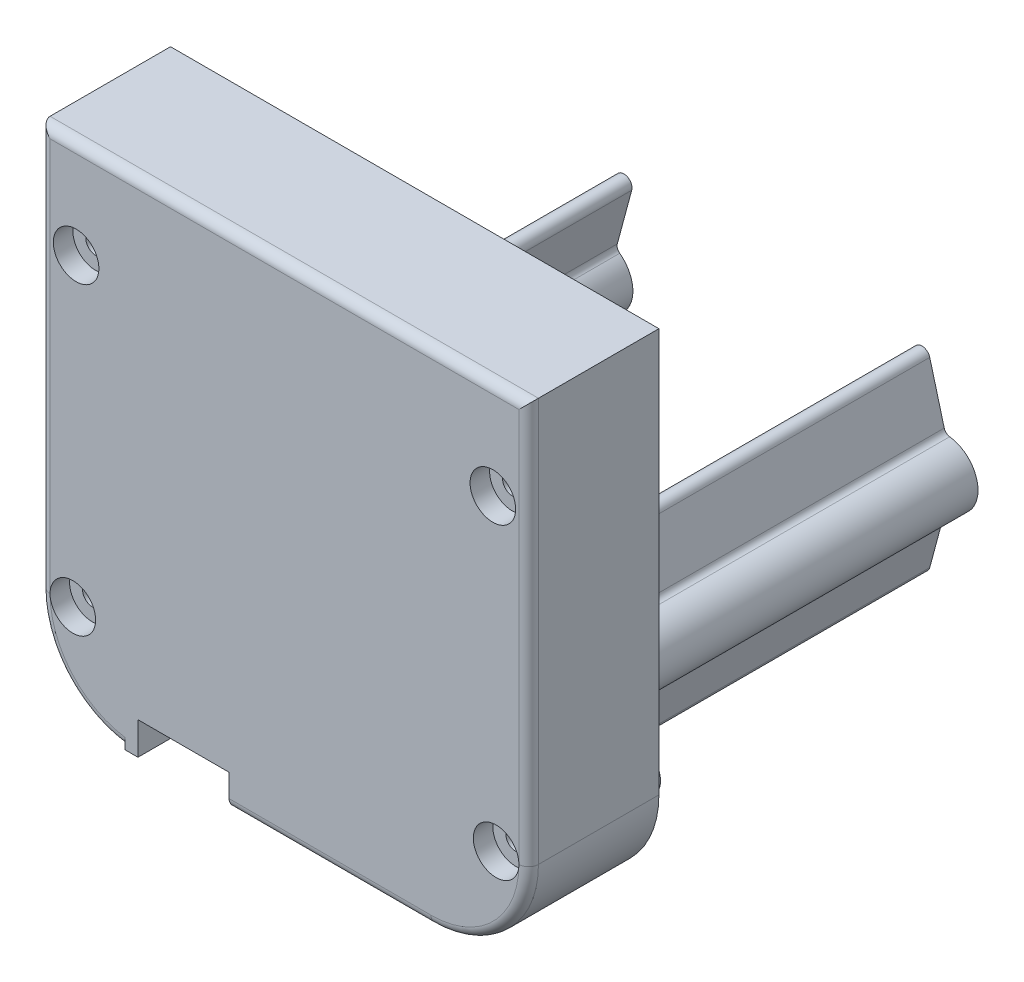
SolidWorks part; units mm, degrees
ref_plane "Plane1" through (0, 0, 0) normal (0, 0, 1) x (1, 0, 0)
ref_plane "Plane2" through (0, 0, 0) normal (0, 1, 0) x (1, 0, 0)
ref_plane "Plane3" through (0, 0, 0) normal (1, 0, 0) x (0, 0, -1)
sketch "Esquisse1" plane through (0, 0, 0) normal (0, 0, 1) x (1, 0, 0)
  line L0 (0, 0) -> (75, 0)
  line L1 (0, 0) -> (0, -62)
  line L2 (60, -77) -> (15, -77)
  line L3 (75, -62) -> (75, 0)
  line L4 (10, -13) -> (65, -13)
  line L5 (10, -13) -> (10, -15)
  line L6 (48, -71) -> (55.9814, -69.1799)
  line L7 (29, -73) -> (46, -73)
  line L8 (37.5, -64.386) -> (37.5, -81.614) construction
  line L9 (46, -70) -> (46, -73)
  line L10 (0, -62) -> (15, -62) construction
  line L11 (15, -62) -> (15, -80) construction
  line L12 (60, -77) -> (60, -62) construction
  line L13 (60, -62) -> (75, -62) construction
  line L14 (-8, -60) -> (15, -60) construction
  line L15 (-15, -15) -> (26, -15) construction
  line L16 (37.5, -59) -> (37.5, 2.5884) construction
  line L17 (15, -4) -> (22, -4)
  line L18 (15, -4) -> (15, -10)
  line L19 (22, -10) -> (15, -10)
  line L20 (22, -10) -> (22, -4)
  line L21 (53, -10) -> (53, -4)
  line L22 (53, -10) -> (60, -10)
  line L23 (60, -4) -> (60, -10)
  line L24 (60, -4) -> (53, -4)
  line L25 (71, -19.2426) -> (71, -57.6125)
  line L26 (4, -19.2426) -> (4, -57.6125)
  line L27 (65, -15) -> (65, -13)
  line L28 (66.685, -65.3826) -> (66.9629, -65.3206)
  line L29 (48, -71) -> (48, -73)
  line L30 (8.315, -65.3826) -> (8.0371, -65.3206)
  line L31 (23.5, -10) -> (51.5, -10)
  line L32 (23.5, -10) -> (23.5, -4)
  line L33 (51.5, -4) -> (23.5, -4)
  line L34 (51.5, -4) -> (51.5, -10)
  line L35 (4.5, -4) -> (13.5, -4)
  line L36 (4.5, -4) -> (4.5, -10)
  line L37 (13.5, -10) -> (4.5, -10)
  line L38 (13.5, -10) -> (13.5, -4)
  line L39 (61.5, -10) -> (61.5, -4)
  line L40 (61.5, -10) -> (70.5, -10)
  line L41 (70.5, -4) -> (70.5, -10)
  line L42 (70.5, -4) -> (61.5, -4)
  line L43 (58, -73) -> (55.9814, -69.1799)
  line L44 (60, -73) -> (57.7664, -68.7729)
  line L45 (48, -73) -> (58, -73)
  line L46 (60, -73) -> (63.6561, -73)
  line L47 (57.7664, -68.7729) -> (69.9259, -66)
  line L48 (46, -70) -> (66.685, -65.3826)
  line L49 (15, -73) -> (11.3439, -73)
  line L50 (29, -70) -> (29, -73)
  line L51 (27, -71) -> (27, -73)
  line L52 (27, -73) -> (17, -73)
  line L53 (17, -73) -> (19.0186, -69.1799)
  line L54 (27, -71) -> (19.0186, -69.1799)
  line L55 (17.2336, -68.7729) -> (5.0741, -66)
  line L56 (15, -73) -> (17.2336, -68.7729)
  line L57 (29, -70) -> (8.315, -65.3826)
  arc A0 (63.6561, -73) -> (69.9259, -66) centre (61.5515, -64.807) ccw
  arc A1 (0, -62) -> (15, -77) centre (15, -62) ccw
  arc A2 (60, -77) -> (75, -62) centre (60, -62) ccw
  circle A3 centre (5, -62) radius 1.5
  circle A4 centre (5.5, -15) radius 1.5
  circle A5 centre (70, -62) radius 1.5
  circle A6 centre (69.5, -15) radius 1.5
  arc A7 (65, -15) -> (71, -19.2426) centre (69.5, -15) ccw
  arc A8 (10, -15) -> (4, -19.2426) centre (5.5, -15) cw
  arc A9 (71, -57.6125) -> (66.9629, -65.3206) centre (70, -62) ccw
  arc A10 (11.3439, -73) -> (5.0741, -66) centre (13.4485, -64.807) cw
  arc A11 (4, -57.6125) -> (8.0371, -65.3206) centre (5, -62) cw
  point P7 (37.5, -73)
  dimension "D7" = 9
  dimension "D12" = 3
  dimension "D14" = 3
  dimension "D21" = 9
  dimension "D1" = 77
  dimension "D2" = 75
  dimension "D3" = 4
  dimension "D4" = 10
  dimension "D5" = 29
  dimension "D6" = 37.5
  dimension "D8" = 18
  dimension "D9" = 15
  dimension "D10" = 15
  dimension "D11" = 60
  dimension "D13" = 15
  dimension "D15" = 6
  dimension "D16" = 7
  dimension "D17" = 10
  dimension "D18" = 15
  dimension "D19" = 13
  dimension "D20" = 4
  dimension "D22" = 6
  dimension "D23" = 28
  dimension "D24" = 14
  dimension "D25" = 9
  dimension "D26" = 1.5
  dimension "D27" = 4
  dimension "D28" = 4
  dimension "D29" = 4
  dimension "D30" = 6
extrude "Base-Extrusion" add sketch "Esquisse1" along normal blind 15
sketch "Esquisse4" plane through (0, 0, 15) normal (0, 0, 1) x (1, 0, 0)
  line L0 (0, 0) -> (75, 0)
  line L1 (75, 0) -> (75, -62)
  line L2 (0, 0) -> (0, -62)
  line L3 (15, -77) -> (60, -77)
  arc A2 (0, -62) -> (15, -77) centre (15, -62) ccw
  arc A3 (60, -77) -> (75, -62) centre (60, -62) ccw
extrude "Boss.-Extru.1" add sketch "Esquisse4" along normal blind 5
sketch "Esquisse5" plane through (0, 0, 20) normal (0, 0, 1) x (1, 0, 0)
  circle A0 centre (5.5, -15) radius 1.5
  dimension "D1" = 3
sketch "Esquisse7" plane through (0, 0, 20) normal (0, 0, 1) x (1, 0, 0)
  circle A0 centre (69.5, -15) radius 1.5
  circle A1 centre (5, -62) radius 1.5
  circle A2 centre (70, -62) radius 1.5
  dimension "D1" = 3
  dimension "D2" = 3
  dimension "D3" = 3
extrude "Enlèv. mat.-Extru.2" cut sketch "Esquisse7" against normal blind 5
extrude "Enlèv. mat.-Extru.3" cut sketch "Esquisse5" against normal blind 5
sketch "Esquisse8" plane through (0, 0, 20) normal (0, 0, 1) x (1, 0, 0)
  circle A0 centre (5.5, -15) radius 3.5
  circle A1 centre (69.5, -15) radius 3.5
  circle A2 centre (70, -62) radius 3.5
  circle A3 centre (5, -62) radius 3.5
  dimension "D1" = 7
  dimension "D2" = 7
  dimension "D3" = 7
  dimension "D4" = 7
extrude "Enlèv. mat.-Extru.4" cut sketch "Esquisse8" against normal blind 3
sketch "Esquisse9" plane through (0, 0, 15) normal (0, 0, -1) x (-1, 0, 0)
  line L0 (-60, -77) -> (-15, -77) construction
  line L1 (0, 0) -> (0, -62) construction
  line L2 (-11, -52) -> (-34, -52) construction
  line L3 (-11, -57) -> (-13.4089, -65.973)
  line L4 (-13.4207, -56.3749) -> (-15.8234, -65.3248)
  line L5 (-11, -47) -> (-13.4089, -38.027)
  line L6 (-13.4207, -47.6251) -> (-15.8234, -38.6752)
  line L7 (-37.5, -73) -> (-37.5, -13) construction
  line L8 (-29, -73) -> (-46, -73) construction
  line L9 (-64, -47) -> (-61.5911, -38.027)
  line L10 (-61.5793, -47.6251) -> (-59.1766, -38.6752)
  line L11 (-61.5793, -56.3749) -> (-59.1766, -65.3248)
  line L12 (-64, -57) -> (-61.5911, -65.973)
  arc A0 (-13.4207, -47.6251) -> (-13.4207, -56.3749) centre (-11, -52) ccw
  arc A1 (-13.4089, -38.027) -> (-15.8234, -38.6752) centre (-14.6162, -38.3511) ccw
  arc A2 (-13.4089, -65.973) -> (-15.8234, -65.3248) centre (-14.6162, -65.6489) cw
  arc A3 (-11, -57) -> (-11, -47) centre (-11, -52) ccw
  arc A4 (-64, -57) -> (-64, -47) centre (-64, -52) cw
  arc A5 (-61.5793, -47.6251) -> (-61.5793, -56.3749) centre (-64, -52) cw
  arc A6 (-61.5911, -38.027) -> (-59.1766, -38.6752) centre (-60.3838, -38.3511) cw
  arc A7 (-61.5911, -65.973) -> (-59.1766, -65.3248) centre (-60.3838, -65.6489) ccw
  dimension "D1" = 10
  dimension "D6" = 2.5
  dimension "D2" = 25
  dimension "D3" = 11
  dimension "D4" = 2.5
  dimension "D5" = 1.25
  dimension "D7" = 37.5
extrude "Boss.-Extru.2" add sketch "Esquisse9" along normal blind 70
sketch "Esquisse11" plane through (0, 0, -55) normal (0, 0, -1) x (-1, 0, 0)
  circle A0 centre (-64, -52) radius 2
  circle A1 centre (-11, -52) radius 2
  dimension "D1" = 4
  dimension "D2" = 4
extrude "Enlèv. mat.-Extru.6" cut sketch "Esquisse11" against normal blind 15
sketch "Esquisse12" plane through (0, 0, 0) normal (0, 0, -1) x (-1, 0, 0)
  circle A0 centre (-69.5, -15) radius 3.25
  circle A1 centre (-5.5, -15) radius 3.25
  circle A2 centre (-70, -62) radius 3.25
  circle A3 centre (-5, -62) radius 3.25
  dimension "D1" = 6.5
  dimension "D2" = 6.5
  dimension "D3" = 6.5
  dimension "D4" = 6.5
extrude "Boss.-Extru.3" add sketch "Esquisse12" along normal blind 2
sketch "Esquisse13" plane through (0, 0, -2) normal (0, 0, -1) x (-1, 0, 0)
  circle A0 centre (-69.5, -15) radius 1.5
  circle A1 centre (-5.5, -15) radius 1.5
  circle A2 centre (-5, -62) radius 1.5
  circle A3 centre (-70, -62) radius 1.5
  dimension "D1" = 3
  dimension "D2" = 3
  dimension "D3" = 3
  dimension "D4" = 3
extrude "Enlèv. mat.-Extru.7" cut sketch "Esquisse13" against normal blind 2
sketch "Esquisse16" plane through (0, -77, 0) normal (0, -1, 0) x (1, 0, 0)
  line L0 (13, 20) -> (13, -4) construction
  line L1 (0, 20) -> (0, 0) construction
  line L2 (13, 20) -> (31, 20)
  line L3 (15, 20) -> (60, 20) construction
  line L4 (13, 20) -> (13, 10)
  line L6 (31, 10) -> (31, 20)
  arc A0 (13, 10) -> (31, 10) centre (22, 10) ccw
  dimension "D1" = 13
extrude "Boss.-Extru.5" add sketch "Esquisse16" against normal blind 8
sketch "Esquisse17" plane through (0, -77, 0) normal (0, -1, 0) x (1, 0, 0)
  line L0 (16, 10) -> (16, 20)
  line L1 (13, 20) -> (60, 20) construction
  line L2 (28, 10) -> (28, 20)
  line L3 (28, 20) -> (16, 20)
  arc A0 (16, 10) -> (28, 10) centre (22, 10) ccw
extrude "Boss.-Extru.6" add sketch "Esquisse17" against normal blind 18
sketch "Esquisse18" plane through (0, -77, 0) normal (0, -1, 0) x (1, 0, 0)
  circle A0 centre (22, 10) radius 2.5
  dimension "D1" = 5
extrude "Enlèv. mat.-Extru.8" cut sketch "Esquisse18" against normal blind 18
sketch "Esquisse19" plane through (0, -77, 0) normal (0, -1, 0) x (1, 0, 0)
  line L4 (15, 10) -> (15, 20)
  line L5 (15, 20) -> (29, 20)
  line L6 (29, 20) -> (29, 10)
  arc A1 (15, 10) -> (29, 10) centre (22, 10) ccw
extrude "Enlèv. mat.-Extru.18" cut sketch "Esquisse19" against normal blind 5
fillet "Congé7" radius 1.5
sketch "Esquisse21" plane through (0, 0, 15) normal (0, 0, -1) x (-1, 0, 0)
  circle A0 centre (-69.5, -15) radius 5
  circle A1 centre (-5.5, -15) radius 5
  circle A2 centre (-5, -62) radius 5
  circle A3 centre (-70, -62) radius 5
  dimension "D1" = 10
  dimension "D2" = 10
  dimension "D3" = 10
  dimension "D4" = 10
extrude "Boss.-Extru.7" add sketch "Esquisse21" along normal blind 3
fillet "Congé10" radius 1
fillet "Congé13" radius 0.4
fillet "Congé16" radius 1
fillet "Congé17" radius 0.5
fillet "Congé18" radius 1
fillet "Congé19" radius 0.5
fillet "Congé20" radius 1
fillet "Congé21" radius 0.5
fillet "Congé22" radius 1
fillet "Congé23" radius 1
fillet "Congé26" radius 1
fillet "Congé27" radius 1
fillet "Congé28" radius 1
fillet "Congé29" radius 1
